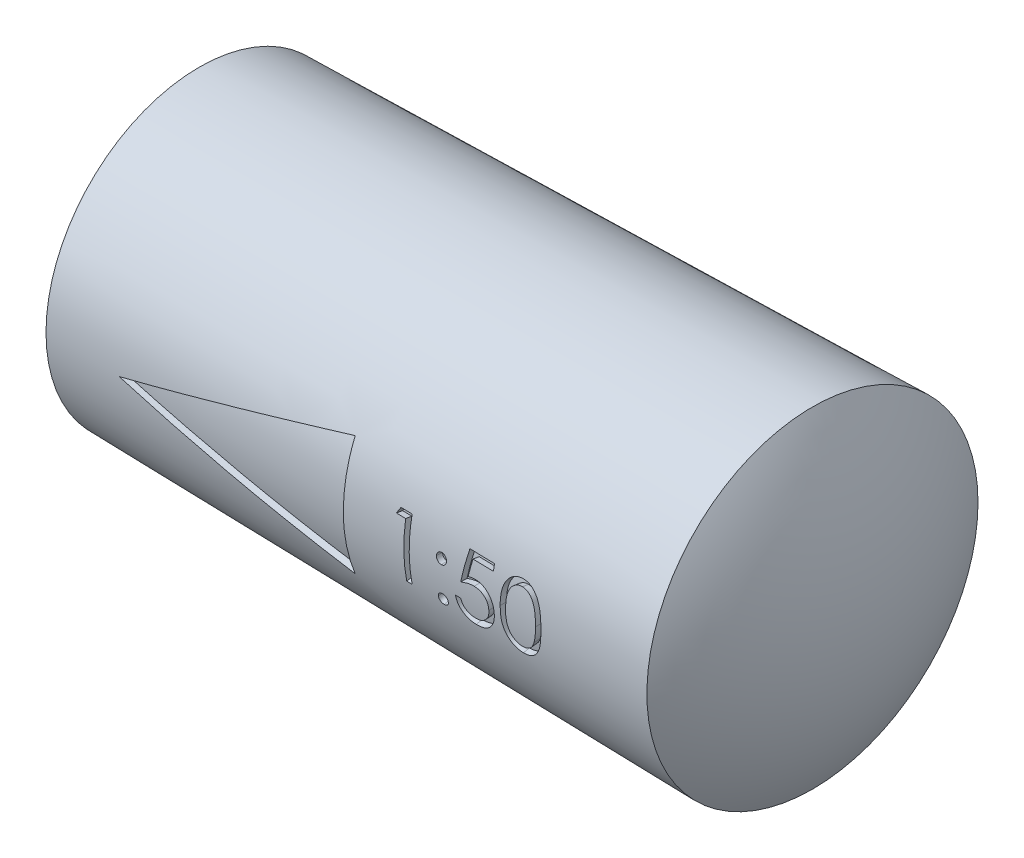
SolidWorks part; units mm, degrees
ref_plane "Front Plane" through (0, 0, 0) normal (0, 0, 1) x (1, 0, 0)
ref_plane "Top Plane" through (0, 0, 0) normal (0, 1, 0) x (1, 0, 0)
ref_plane "Right Plane" through (0, 0, 0) normal (1, 0, 0) x (0, 0, -1)
sketch "Sketch1" plane through (0, 0, 0) normal (1, 0, 0) x (0, 0, -1)
  circle A0 centre (0, 0) radius 2.5
  dimension "D1" = 5
extrude "Extrude1" add sketch "Sketch1" along normal mid plane 10
draft "Draft1" type of draft neutral plane draft angle 1.146 faces to draft 1 parameters "D1"=1.146
sketch "Sketch2" plane through (0, 0, 0) normal (0, 0, 1) x (1, 0, 0)
  line L0 (-5, 0) -> (-5, 2.5)
  line L1 (-5, 2.5) -> (-5, -2.5) construction
  line L2 (-5, 0) -> (-5.75, 0)
  line L3 (-5.75, 0) -> (-5.75, -2.6) construction
  line L4 (5, 0) -> (5, 2.7)
  line L5 (5, -2.7) -> (5, 2.7) construction
  line L6 (5, 0) -> (5.75, 0)
  line L7 (5.75, 0) -> (5.75, -2.6) construction
  line L8 (-5, -2.5) -> (5, -2.7) construction
  arc A0 (-5.75, 0) -> (-5, 2.5) centre (-1.2083, 0) cw
  arc A1 (5.75, 0) -> (5, 2.7) centre (0.515, 0) ccw
  point P14 (0, -2.6)
revolve "Revolve1" add sketch "Sketch2" angle 360 about L2
sketch "Sketch5" plane through (0, 0, 0) normal (0, 0, 1) x (1, 0, 0)
  line L0 (0, 2.6) -> (0, -2.6) construction
  line L1 (5, 2.7) -> (-5, 2.5) construction
  line L2 (-5, -2.5) -> (5, -2.7) construction
ref_plane "Plane2" through (0, 0, 0) normal (-0.02, 0, 0.9998) x (0.9998, 0, 0.02)
sketch "Sketch6" plane through (0, 0, 0) normal (-0.02, 0, 0.9998) x (0.9998, 0, 0.02)
  line L0 (0, 0) -> (0, 1)
  line L1 (0, 2.6) -> (0, -2.6) construction
  line L2 (0, 1) -> (-3.7321, 0)
  line L3 (-3.7321, 0) -> (0, -1)
  line L4 (0, -1) -> (0, 0)
  line L5 (0, -0.5) -> (4, -0.5) construction
  text T0 "1:50" font "Century Gothic" height 1
  dimension "D1" = 2
  dimension "D2" = 30
  dimension "D3" = 4
wrap "Wrap2" sketch "Sketch6" wrap type deboss source sketch "Sketch6" thickness 0.1 parameters "D1"=0.1
equation "\"D2@Sketch2\" = \"D1@Sketch2\""
